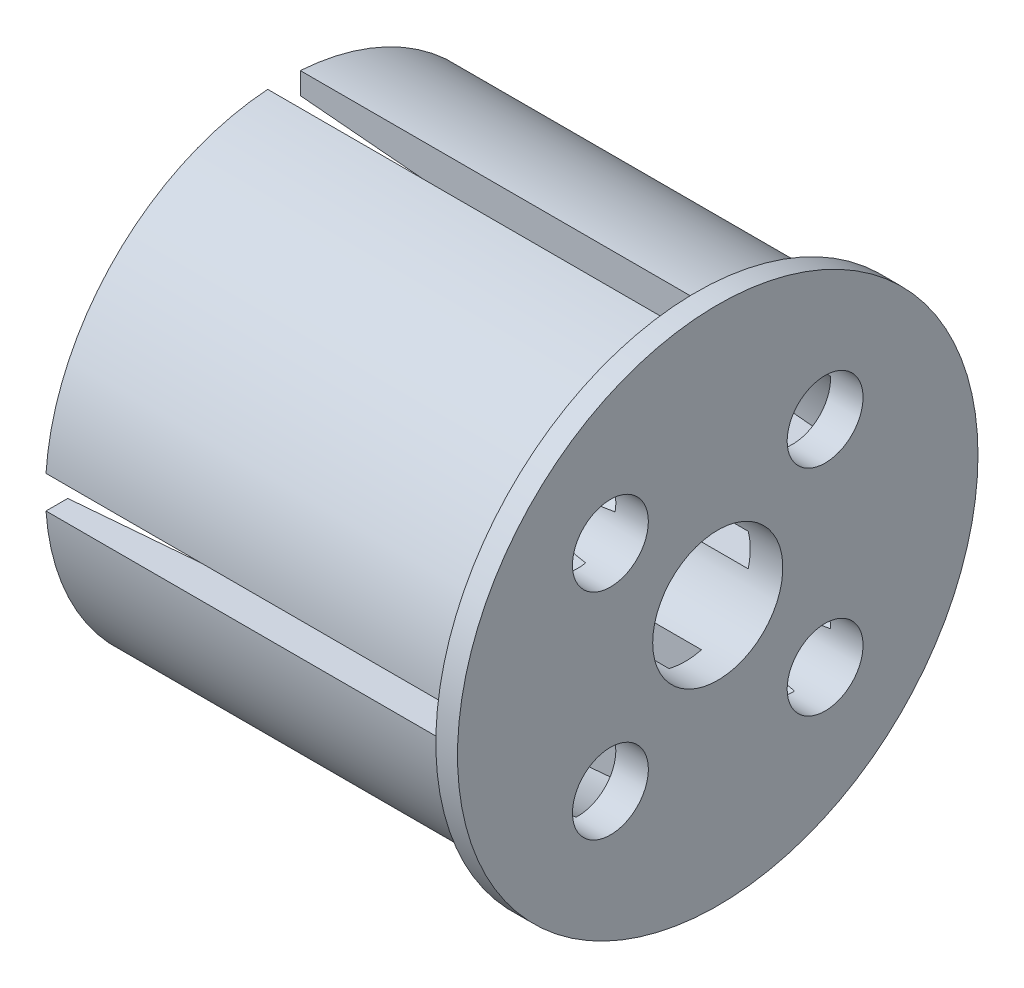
SolidWorks part; units mm, degrees
ref_plane "Front Plane" through (0, 0, 0) normal (0, 0, 1) x (1, 0, 0)
ref_plane "Top Plane" through (0, 0, 0) normal (0, 1, 0) x (1, 0, 0)
ref_plane "Right Plane" through (0, 0, 0) normal (1, 0, 0) x (0, 0, -1)
sketch "Sketch1" plane through (0, 0, 0) normal (0, 0, 1) x (1, 0, 0)
  line L0 (0, 0) -> (20, 0) construction
  line L1 (0, 0) -> (0, 3) construction
  line L2 (0, 3) -> (20, 3)
  line L3 (20, 3) -> (20, 11)
  line L4 (20, 11) -> (0, 11)
  line L5 (0, 11) -> (0, 10)
  line L6 (0, 10) -> (18.5, 8.3815)
  line L7 (18.5, 8.3815) -> (18.5, 5.6185)
  line L8 (18.5, 5.6185) -> (0, 4)
  line L9 (0, 4) -> (0, 3)
  line L10 (18.5, 7) -> (20, 7) construction
  line L11 (0, 9.6372) -> (0, 4.3628) construction
  line L12 (0, 4.3628) -> (3, 4.3628)
  line L13 (3, 4.3628) -> (16, 5.5002)
  line L14 (16, 5.5002) -> (16, 8.4998)
  line L15 (16, 8.4998) -> (3, 9.6372)
  line L16 (3, 9.6372) -> (0, 9.6372)
  line L17 (20, 3) -> (20, 0) construction
  dimension "D1" = 3
  dimension "D2" = 11
  dimension "D3" = 20
  dimension "D4" = 1
  dimension "D5" = 5
  dimension "D6" = 1.5
  dimension "D7" = 0.1
  dimension "D8" = 0.1
  dimension "D9" = 4
  dimension "D10" = 3
  dimension "D11" = 3
revolve "Revolve1" add sketch "Sketch1" angle 360 about L0
sketch "Sketch2" plane through (0, 0, 0) normal (-1, 0, 0) x (0, 0, 1)
  line L1 (11, 0.75) -> (-11, 0.75)
  line L2 (11, 0.75) -> (11, -0.75)
  line L3 (11, -0.75) -> (-11, -0.75)
  line L4 (-11, 0.75) -> (-11, -0.75)
  line L5 (11, 0.75) -> (-11, -0.75) construction
  line L6 (11, -0.75) -> (-11, 0.75) construction
  line L7 (0.75, 11) -> (-0.75, 11)
  line L8 (0.75, 11) -> (0.75, -11)
  line L9 (0.75, -11) -> (-0.75, -11)
  line L10 (-0.75, 11) -> (-0.75, -11)
  line L11 (0.75, 11) -> (-0.75, -11) construction
  line L12 (0.75, -11) -> (-0.75, 11) construction
  circle A0 centre (0, 0) radius 11 construction
  point P0 (0, 0)
  point P6 (0, 0)
  dimension "D1" = 1.5
extrude "Cut-Extrude1" cut sketch "Sketch2" against normal up to surface (18.5 mm away) contours L10 L1 L3 M9 | L3 L1 M9 M10 | L10 L8 M10 M9 | L3 L1 M10 M9 | L10 L8 M9 M10 | L3 L10 L8 M9 | L1 L8 L3 M9 | L10 L1 L8 M9
sketch "Sketch3" plane through (20, 0, 0) normal (1, 0, 0) x (0, 0, -1)
  line L1 (4.9497, -4.9497) -> (-4.9497, -4.9497)
  line L2 (4.9497, -4.9497) -> (4.9497, 4.9497)
  line L3 (4.9497, 4.9497) -> (-4.9497, 4.9497)
  line L4 (-4.9497, -4.9497) -> (-4.9497, 4.9497)
  line L5 (4.9497, -4.9497) -> (-4.9497, 4.9497) construction
  line L6 (4.9497, 4.9497) -> (-4.9497, -4.9497) construction
  line L8 (-0.75, 10.9744) -> (-0.75, 8.3478)
  line L9 (0.75, 8.3478) -> (0.75, 10.9744)
  line L10 (10.9744, 0.75) -> (8.3478, 0.75)
  line L11 (8.3478, -0.75) -> (10.9744, -0.75)
  line L12 (0.75, -10.9744) -> (0.75, -8.3478)
  line L13 (-0.75, -8.3478) -> (-0.75, -10.9744)
  line L14 (-10.9744, -0.75) -> (-8.3478, -0.75)
  line L15 (-8.3478, 0.75) -> (-10.9744, 0.75)
  line L16 (-0.75, 10.9744) -> (-0.75, 8.3478)
  line L17 (0.75, 8.3478) -> (0.75, 10.9744)
  line L18 (10.9744, 0.75) -> (8.3478, 0.75)
  line L19 (8.3478, -0.75) -> (10.9744, -0.75)
  line L20 (0.75, -10.9744) -> (0.75, -8.3478)
  line L21 (-0.75, -8.3478) -> (-0.75, -10.9744)
  line L22 (-10.9744, -0.75) -> (-8.3478, -0.75)
  line L23 (-8.3478, 0.75) -> (-10.9744, 0.75)
  circle A0 centre (0, 0) radius 7
  arc A1 (-0.75, 5.5683) -> (-5.5683, 0.75) centre (0, 0) ccw construction
  arc A2 (-0.75, 5.5683) -> (-5.5683, 0.75) centre (0, 0) ccw
  circle A3 centre (-4.9497, 4.9497) radius 1.75
  arc A8 (-0.75, 8.3478) -> (-8.3478, 0.75) centre (0, 0) ccw
  arc A9 (0.75, 10.9744) -> (-0.75, 10.9744) centre (0, 0) ccw
  arc A10 (8.3478, 0.75) -> (0.75, 8.3478) centre (0, 0) ccw
  arc A11 (10.9744, -0.75) -> (10.9744, 0.75) centre (0, 0) ccw
  arc A12 (0.75, -8.3478) -> (8.3478, -0.75) centre (0, 0) ccw
  arc A13 (-0.75, -10.9744) -> (0.75, -10.9744) centre (0, 0) ccw
  arc A14 (-8.3478, -0.75) -> (-0.75, -8.3478) centre (0, 0) ccw
  arc A15 (-10.9744, 0.75) -> (-10.9744, -0.75) centre (0, 0) ccw
  arc A16 (-0.75, 8.3478) -> (-8.3478, 0.75) centre (0, 0) ccw
  arc A17 (0.75, 10.9744) -> (-0.75, 10.9744) centre (0, 0) ccw
  arc A18 (8.3478, 0.75) -> (0.75, 8.3478) centre (0, 0) ccw
  arc A19 (10.9744, -0.75) -> (10.9744, 0.75) centre (0, 0) ccw
  arc A20 (0.75, -8.3478) -> (8.3478, -0.75) centre (0, 0) ccw
  arc A21 (-0.75, -10.9744) -> (0.75, -10.9744) centre (0, 0) ccw
  arc A22 (-8.3478, -0.75) -> (-0.75, -8.3478) centre (0, 0) ccw
  arc A23 (-10.9744, 0.75) -> (-10.9744, -0.75) centre (0, 0) ccw
  dimension "D3" = 3.5
  dimension "D2" = 14
  dimension "D1" = 0
extrude "Cut-Extrude2" cut sketch "Sketch3" against normal through all contours A0 A3 L4 | A2 A3 | L4 A3 A2 L3 | L3 A3 A0 | A3 A16 A0 | A16 A3
pattern_circular "CirPattern1" count 4 over 360 about axis through (0, 0, 0) along (1, 0, 0) of "Cut-Extrude2"
sketch "Sketch4" plane through (20, 0, 0) normal (1, 0, 0) x (0, 0, -1)
  circle A0 centre (0, 0) radius 11 construction
  circle A1 centre (0, 0) radius 11
  circle A2 centre (0, 0) radius 12
  dimension "D1" = 1
extrude "Boss-Extrude1" add sketch "Sketch4" against normal blind 1
